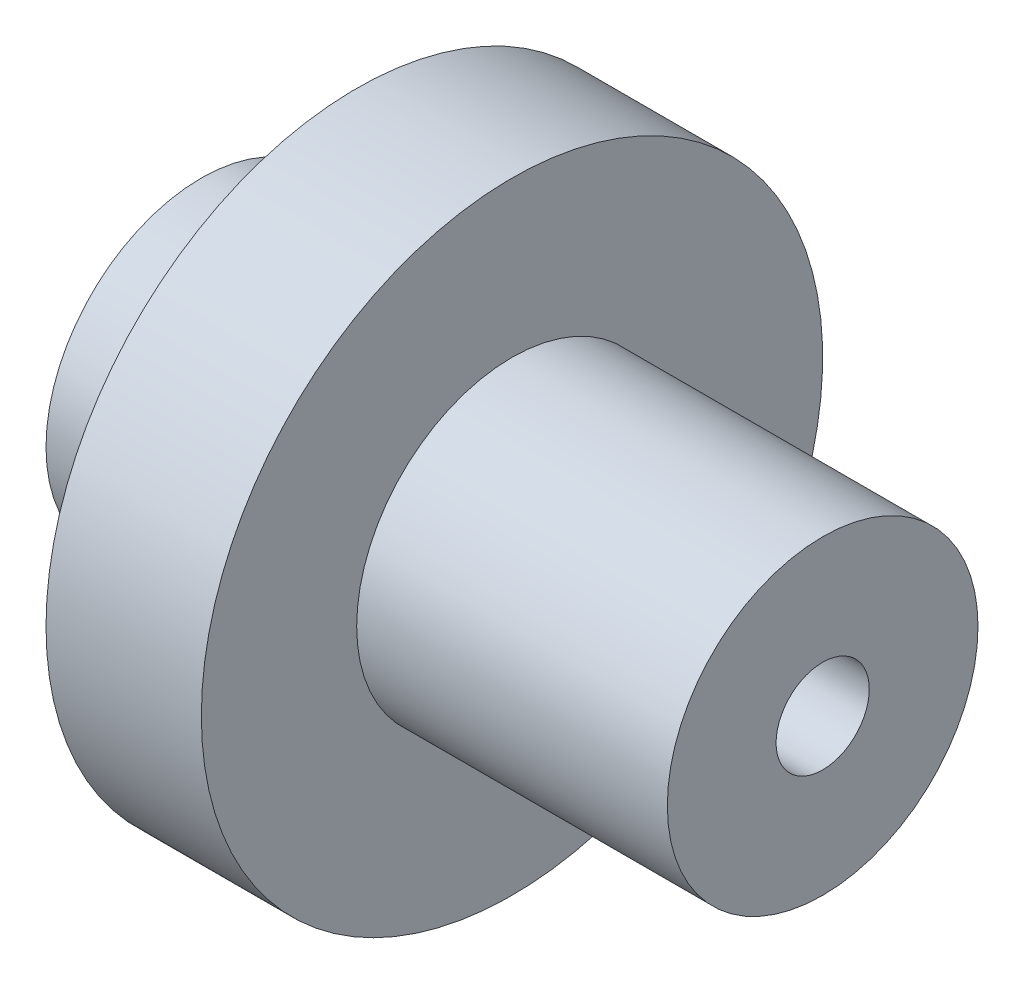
SolidWorks part; units mm, degrees
ref_plane "Front Plane" through (0, 0, 0) normal (0, 0, 1) x (1, 0, 0)
ref_plane "Top Plane" through (0, 0, 0) normal (0, 1, 0) x (1, 0, 0)
ref_plane "Right Plane" through (0, 0, 0) normal (1, 0, 0) x (0, 0, -1)
sketch "Sketch1" plane through (0, 0, 0) normal (1, 0, 0) x (0, 0, -1)
  circle A0 centre (0, 0) radius 5
  dimension "D1" = 10
extrude "Extrude1" add sketch "Sketch1" along normal blind 20
sketch "Sketch2" plane through (0, 0, 0) normal (-1, 0, 0) x (0, 0, 1)
  circle A0 centre (0, 0) radius 1.5
  dimension "D1" = 3
extrude "Extrude2" cut sketch "Sketch2" against normal blind 10
sketch "Sketch3" plane through (20, 0, 0) normal (1, 0, 0) x (0, 0, -1)
  circle A0 centre (0, 0) radius 1.5
  dimension "D1" = 3
extrude "Extrude3" cut sketch "Sketch3" against normal blind 11
sketch "Sketch4" plane through (0, 0, 0) normal (0, 0, 1) x (1, 0, 0)
  line L0 (5, 5) -> (5, 10)
  line L1 (20, 5) -> (0, 5) construction
  line L2 (5, 10) -> (10, 10)
  line L3 (10, 10) -> (10, 5)
  line L4 (10, 5) -> (5, 5)
  line L5 (0, 0) -> (16.5831, 0) construction
  line L6 (0, 5) -> (0, -5) construction
  dimension "D1" = 5
  dimension "D2" = 5
  dimension "D3" = 10
revolve "Revolve1" add sketch "Sketch4" angle 360 about L5
